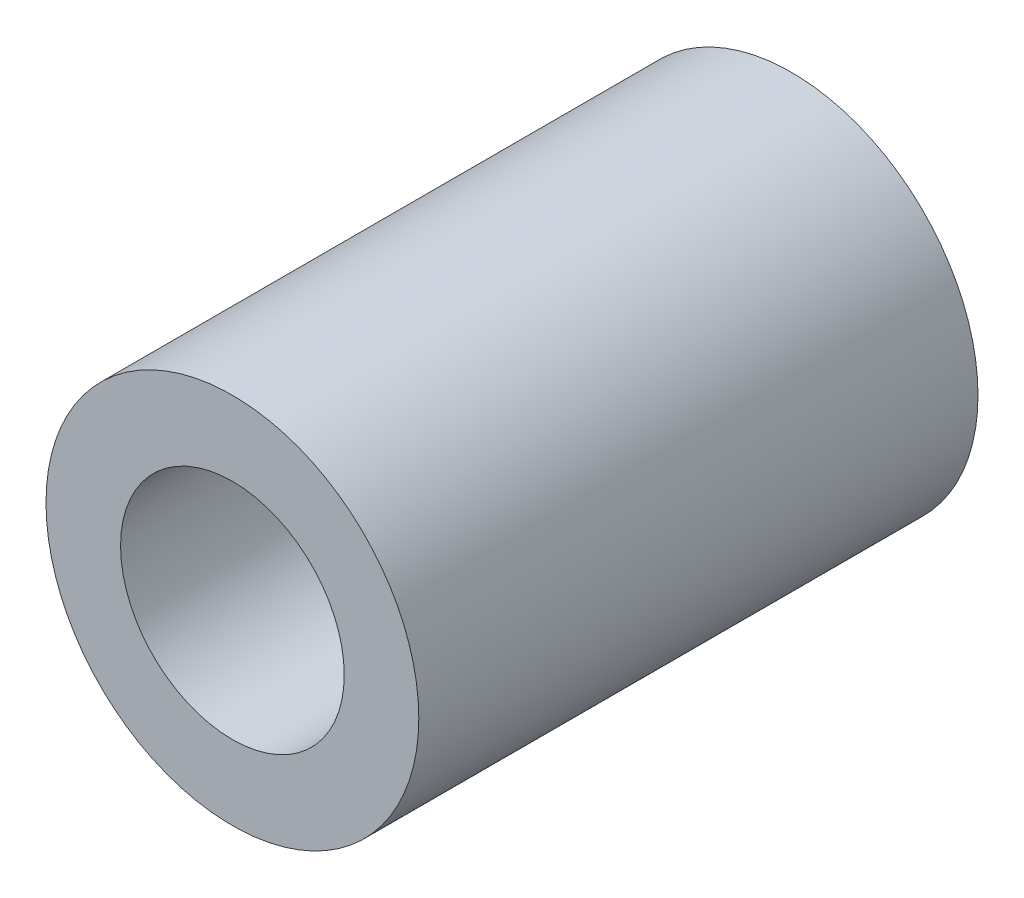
SolidWorks part; units mm, degrees
ref_plane "Plan de face" through (0, 0, 0) normal (0, 0, 1) x (1, 0, 0)
ref_plane "Plan de dessus" through (0, 0, 0) normal (0, 1, 0) x (1, 0, 0)
ref_plane "Plan de droite" through (0, 0, 0) normal (1, 0, 0) x (0, 0, -1)
sketch "Esquisse1" plane through (0, 0, 0) normal (0, 0, 1) x (1, 0, 0)
  circle A0 centre (0, 0) radius 6
  circle A1 centre (0, 0) radius 10
  dimension "D1" = 12
  dimension "D2" = 20
extrude "Extrusion1" add sketch "Esquisse1" along normal blind 30
